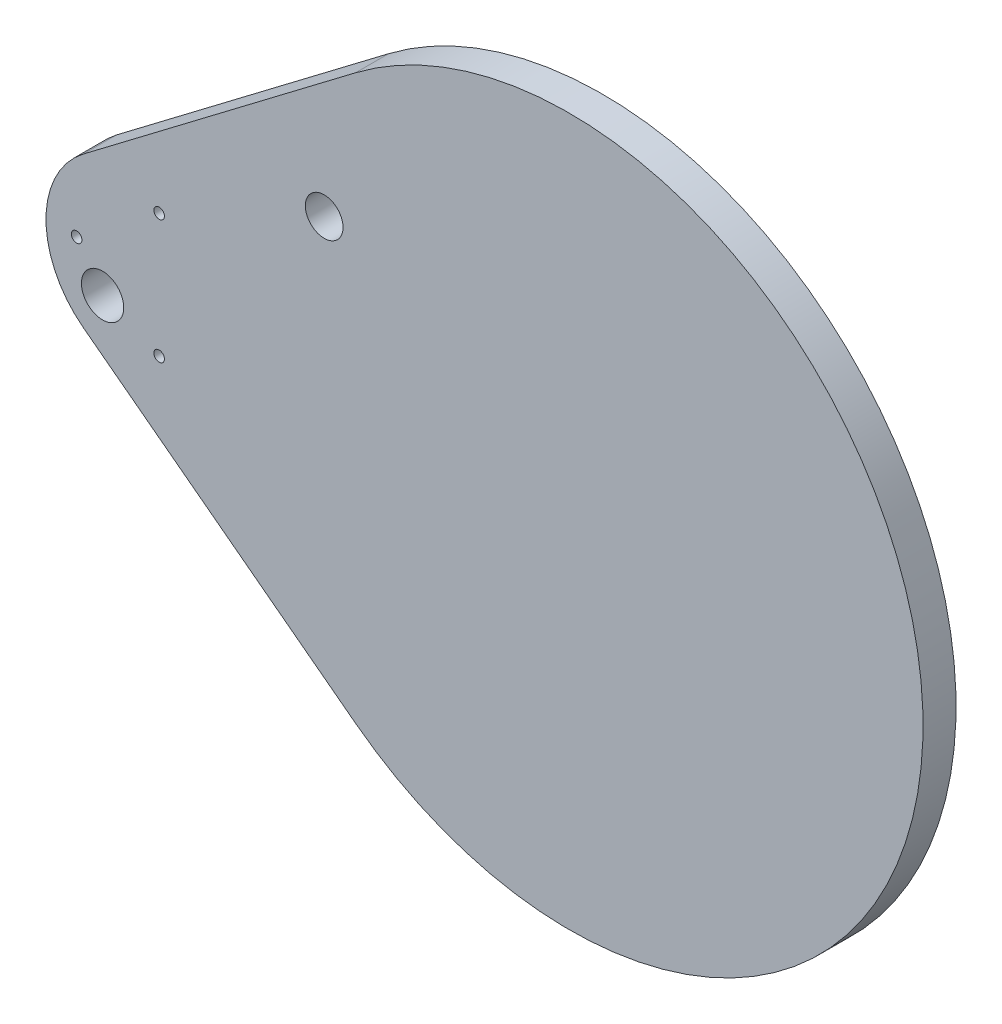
SolidWorks part; units mm, degrees
ref_plane "Plane1" through (0, 0, 0) normal (0, 0, 1) x (1, 0, 0)
ref_plane "Plane2" through (0, 0, 0) normal (0, 1, 0) x (1, 0, 0)
ref_plane "Plane3" through (0, 0, 0) normal (1, 0, 0) x (0, 0, -1)
sketch "Sketch3" plane through (0, 0, 0) normal (0, 0, 1) x (1, 0, 0)
  line L0 (-327.3041, 50.5895) -> (-143.9217, 189.7105)
  line L1 (317.3094, 0) -> (-739.4672, 0) construction
  line L2 (-327.3041, -50.5895) -> (-143.9217, -189.7105)
  arc A0 (-143.9217, -189.7105) -> (-143.9217, 189.7105) centre (0, 0) ccw
  arc A1 (-327.3041, 50.5895) -> (-327.3041, -50.5895) centre (-288.925, 0) ccw
  dimension "D1" = 238.125
  dimension "D2" = 63.5
  dimension "D3" = 288.925
extrude "Base-Extrude" add sketch "Sketch3" along normal blind 22.225
sketch "Sketch4" plane through (0, 0, 0) normal (0, 0, -1) x (-1, 0, 0)
  circle A0 centre (288.925, 0) radius 11.1125
  dimension "D1" = 22.225
extrude "Cut-Extrude1" cut sketch "Sketch4" against normal blind 6.35
sketch "Sketch5" plane through (0, 0, 0) normal (0, 0, -1) x (-1, 0, 0)
  circle A0 centre (314.325, -25.4) radius 14.224
  dimension "D1" = 28.448
  dimension "D2" = 314.325
  dimension "D3" = 25.4
extrude "Cut-Extrude2" cut sketch "Sketch5" against normal through all
sketch "Sketch6" plane through (0, 0, 0) normal (0, 0, -1) x (-1, 0, 0)
  line L0 (385.5839, 0) -> (-277.1264, 0) construction
  circle A0 centre (331.7748, 0) radius 3.556
  dimension "D1" = 7.112
  dimension "D2" = 331.7748
extrude "Cut-Extrude3" cut sketch "Sketch6" against normal through all
sketch "Sketch7" plane through (0, 0, 0) normal (0, 0, -1) x (-1, 0, 0)
  line L0 (388.9225, 0) -> (-270.4492, 0) construction
  circle A0 centre (276.225, 41.656) radius 3.556
  dimension "D1" = 7.112
  dimension "D2" = 41.656
  dimension "D3" = 276.225
extrude "Cut-Extrude4" cut sketch "Sketch7" against normal through all
sketch "Sketch8" plane through (0, 0, 0) normal (0, 0, -1) x (-1, 0, 0)
  line L0 (395.8263, 0) -> (396.7664, 0) construction
sketch "Sketch9" plane through (0, 0, 0) normal (0, 0, -1) x (-1, 0, 0)
  circle A0 centre (276.225, -41.656) radius 3.556
  dimension "D1" = 7.112
  dimension "D2" = 83.312
  dimension "D3" = 276.225
extrude "Cut-Extrude5" cut sketch "Sketch9" against normal through all
sketch "Sketch10" plane through (0, 0, 0) normal (0, 0, -1) x (-1, 0, 0)
  circle A0 centre (165.1, 95.25) radius 12.7
  dimension "D1" = 25.4
  dimension "D2" = 165.1
  dimension "D3" = 95.25
extrude "Cut-Extrude6" cut sketch "Sketch10" against normal through all
